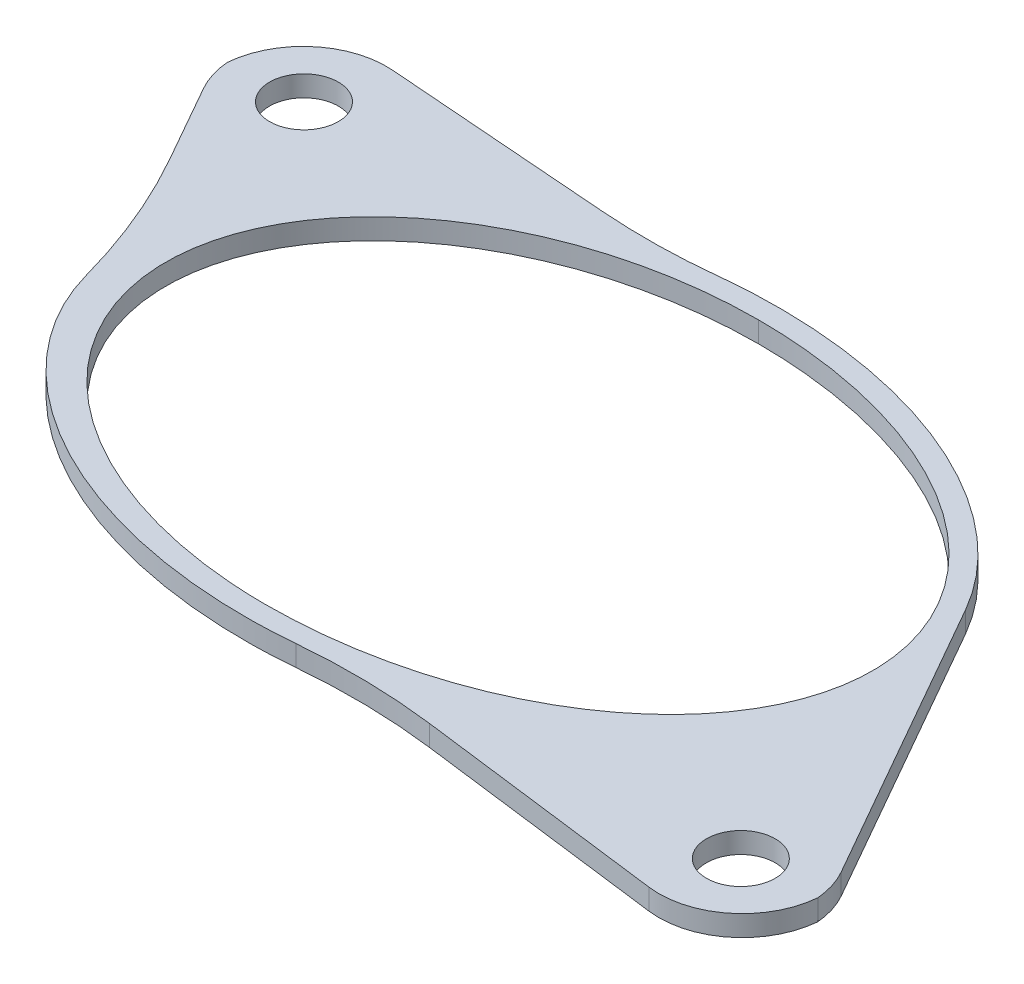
SolidWorks part; units mm, degrees
ref_plane "Front Plane" through (0, 0, 0) normal (0, 0, 1) x (1, 0, 0)
ref_plane "Top Plane" through (0, 0, 0) normal (0, 1, 0) x (1, 0, 0)
ref_plane "Right Plane" through (0, 0, 0) normal (1, 0, 0) x (0, 0, -1)
sketch "Sketch1" plane through (0, 0, 0) normal (0, 1, 0) x (1, 0, 0)
  line L0 (-23.5, 13.7777) -> (-5, 12.3638)
  line L1 (-23.5, 9.0762) -> (-18.35, 0)
  line L2 (25.5, -14.9739) -> (5, -12.3638)
  line L3 (25.5, -14.9739) -> (25.5, -10.0725)
  line L4 (-23.5, 13.7777) -> (-23.5, 9.0762)
  line L5 (-20, 10) -> (-19.7333, 13.4898) construction
  line L6 (-20, 10) -> (-23.5, 10) construction
  line L7 (-20, 10) -> (-23.0441, 8.2727) construction
  line L8 (25.5, -10.0725) -> (17.0423, 4.7641)
  line L9 (22, -11) -> (21.5579, -14.472) construction
  line L10 (22, -11) -> (25.5, -11) construction
  line L11 (22, -11) -> (25.0406, -9.2667) construction
  circle A0 centre (22, -11) radius 1.65
  circle A1 centre (-20, 10) radius 1.65
  ellipse E0 centre (0, 0) end of major axis (-18.35, 0) minor radius 12.85 (-18.35, 0) -> (5, -12.3638) ccw
  ellipse E1 centre (0, 0) end of major axis (-17.35, 0) minor radius 11.85 (0, -11.85) -> (0, 11.85) ccw
  ellipse E2 centre (0, 0) end of major axis (-18.35, 0) minor radius 12.85 (17.0423, 4.7641) -> (-5, 12.3638) ccw
  ellipse E3 centre (0, 0) end of major axis (-16.65, 0) minor radius 11.85 (0, -11.85) -> (0, 11.85) cw
  dimension "D9" = 3.3
  dimension "D1" = 36.7
  dimension "D2" = 1
  dimension "D3" = 1
  dimension "D4" = 25.7
  dimension "D5" = 22
  dimension "D6" = 11
  dimension "D7" = 10
  dimension "D8" = 20
  dimension "D10" = 3.5
  dimension "D11" = 5
  dimension "D12" = 5
  dimension "D13" = 3.5
  dimension "D14" = 0.7
extrude "Boss-Extrude1" add sketch "Sketch1" along normal blind 1
fillet "Fillet1" radius 30 3 edges at (-5, 0.5, -12.3638) (5, 0.5, 12.3638) (-18.35, 0.5, 0)
fillet "Fillet2" radius 4 4 edges at (-23.5, 0.5, -13.7777) (-23.5, 0.5, -9.0762) (25.5, 0.5, 10.0725) (25.5, 0.5, 14.9739)
